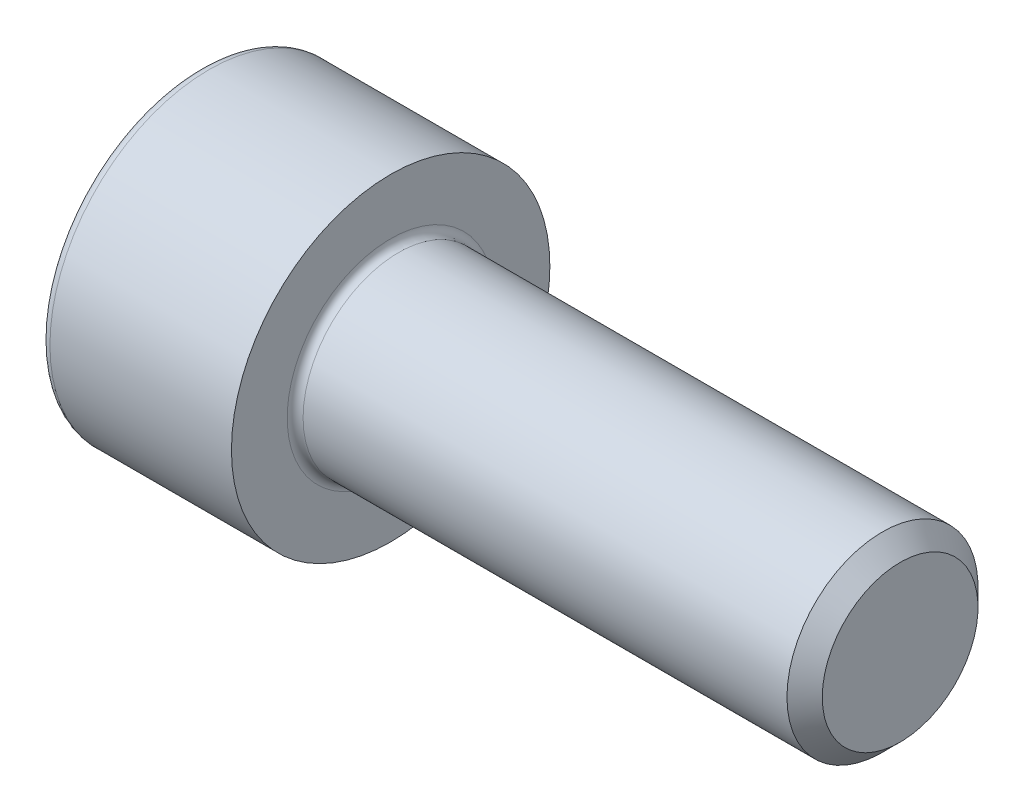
SolidWorks part; units mm, degrees
ref_plane "Plane1" through (0, 0, 0) normal (0, 0, 1) x (1, 0, 0)
ref_plane "Plane2" through (0, 0, 0) normal (0, 1, 0) x (1, 0, 0)
ref_plane "Plane3" through (0, 0, 0) normal (1, 0, 0) x (0, 0, -1)
revolve "Base-Revolve" add sketch "BodySke"
sketch "BodySke" plane through (0, 0, 0) normal (0, 0, 1) x (1, 0, 0)
  line L0 (0, 0) -> (0, 5)
  line L1 (0, 5) -> (6, 5)
  line L2 (6, 5) -> (6, 3)
  line L3 (6, 3) -> (21.4455, 3)
  line L4 (22, 2.4455) -> (22, 0)
  line L5 (22, 0) -> (0, 0)
  line L6 (-31.75, 0) -> (127, 0) construction
  line L8 (22, 2.4455) -> (21.4455, 3)
  line L10 (22, -2.4455) -> (21.4455, -3) construction
  line L11 (7, 9.525) -> (7, 3.175) construction
  line L12 (6, 9.525) -> (6, 3.175) construction
  line L13 (-38, 9.525) -> (-38, 3.175) construction
  dimension "Diameter" = 6
  dimension "Head_ht" = 6
  dimension "Length" = 16
  dimension "Body_ch_ang" = 45
  dimension "Head_dia" = 10
  dimension "Minor_dia" = 4.891
  dimension "Advance" = 1
  dimension "Thread_nom" = 16
  dimension "Thread_length" = 60
fillet "Fillet1" radius 0.25 1 edges at (6, 0, 3)
fillet "Fillet2" radius 0.3 1 edges at (0, 0, 5)
sketch "Sketch2" plane through (0, 0, 0) normal (0, 0, 1) x (1, 0, 0)
  line L0 (0, 2.542) -> (3, 2.542)
  line L1 (3, 2.542) -> (4.4676, 0)
  line L2 (-31.75, 0) -> (127, 0) construction
  line L3 (4.4676, 0) -> (0, 0)
  line L4 (0, 0) -> (0, 2.542)
  line L6 (0, 0) -> (47.625, 0) construction
  dimension "D1" = 2.542
  dimension "D2" = 60
  dimension "Depth" = 3
revolve "Hex-PreBroach" cut sketch "Sketch2" angle 360 about L6
sketch "Sketch3" plane through (0, 0, 0) normal (-1, 0, 0) x (0, 0.5, 0.866)
  line L0 (1.4676, 2.542) -> (-1.4676, 2.542)
  line L1 (-1.4676, 2.542) -> (-2.9352, 0)
  line L2 (1.4676, 2.542) -> (2.9352, 0)
  line L3 (1.4676, -2.542) -> (2.9352, 0)
  line L4 (1.4676, -2.542) -> (-1.4676, -2.542)
  line L5 (-1.4676, -2.542) -> (-2.9352, 0)
  dimension "D1" = 2.542
  dimension "D2" = 2.542
  dimension "Hex_size" = 5.084
extrude "Hex" cut sketch "Sketch3" against normal blind 3
sketch "ThdSchSke" plane through (0, 0, 0) normal (0, 0, 1) x (1, 0, 0)
  line L0 (9, -2.4455) -> (8.6117, -3)
  line L1 (9, -2.4455) -> (9.3883, -3)
  line L2 (9.3883, -3) -> (9.3883, -3.75)
  line L3 (-3.175, 0) -> (5.1513, 0) construction
  line L4 (0, 4.7) -> (0, -4.7) construction
  line L5 (9.3883, -3.75) -> (8.6117, -3.75)
  line L6 (8.6117, -3.75) -> (8.6117, -3)
  dimension "Thread_minor" = 4.891
  dimension "Diameter" = 6
  dimension "Start" = 9
  dimension "SideAngle" = 55
  dimension "VeeAngle" = 70
  dimension "Overcut" = 7.5
revolve "ThreadSchematic" [suppressed] cut sketch "ThdSchSke" angle 360 about L3
pattern_linear "ThdSchPat" [suppressed]
equation "\"D2@Sketch3\" = \"Hex_size@Sketch3\" / 2"
equation "\"D1@Sketch3\" = \"Hex_size@Sketch3\" / 2"
equation "\"D1@Sketch2\" = \"Hex_size@Sketch3\" / 2"
equation "\"Thread_minor@ThreadCosmetic\"  =  \"Minor_dia@BodySke\""
equation "\"Depth@Sketch2\" =  \"Key_eng@Hex\""
equation "\"Thread_length@ThreadCosmetic\" = ((sgn( (\"Length@BodySke\" - \"Advance@BodySke\" * 3.0) - \"Thread_nom@BodySke\" )-1)*( (\"Length@BodySke\" - \"Advance@BodySke\" * 3.0) - \"Thread_nom@BodySke\" ))/-2+ \"Thread_no"
equation "\"Thread_minor@ThdSchSke\" = \"Minor_dia@BodySke\""
equation "\"Diameter@ThdSchSke\" = \"Diameter@BodySke\""
equation "\"Overcut@ThdSchSke\" = \"Diameter@BodySke\" * 1.25"
equation "\"Start@ThdSchSke\" = \"Head_ht@BodySke\" + \"Length@BodySke\" - \"Thread_length@ThreadCosmetic\"  '---Non-countersunk---"
equation "\"Num_threads@ThdSchPat\" = int( \"Thread_length@ThreadCosmetic\" / \"Advance@BodySke\" + 0.999 )  + 1"
equation "\"Advance@ThdSchPat\" = \"Thread_length@ThreadCosmetic\" /  (\"Num_threads@ThdSchPat\" - 1) 'relax it"
equation "\"Num_threads@ThdSchPat\" = \"Num_threads@ThdSchPat\" - sgn( \"Num_threads@ThdSchPat\" - 1) '---chamfered tips only---"
